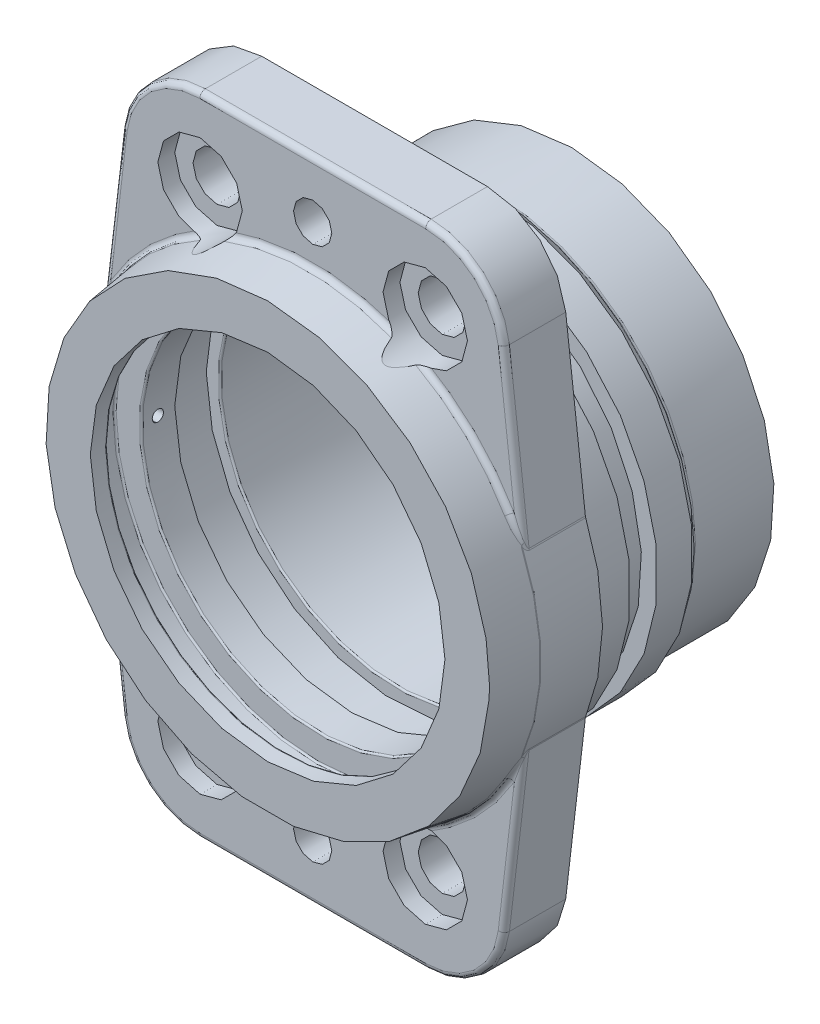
SolidWorks part; units mm, degrees
ref_plane "Face" through (0, 0, 0) normal (0, 0, 1) x (1, 0, 0)
ref_plane "Dessus" through (0, 0, 0) normal (0, 1, 0) x (1, 0, 0)
ref_plane "Droite" through (0, 0, 0) normal (1, 0, 0) x (0, 0, -1)
sketch "Esquisse1" plane through (0, 0, 0) normal (0, 0, 1) x (1, 0, 0)
  line L0 (0, -73.3205) -> (0, 88.7114) construction
  line L1 (-81.0159, 0) -> (84.0086, 0) construction
  line L2 (-20.0515, 57.5) -> (20.0515, 57.5)
  line L3 (-33.9555, 45.1369) -> (-38.7325, 4.5599)
  line L4 (33.9555, 45.1369) -> (38.7325, 4.5599)
  line L5 (33.9555, -45.1369) -> (38.7325, -4.5599)
  line L6 (-20.0515, -57.5) -> (20.0515, -57.5)
  line L7 (-33.9555, -45.1369) -> (-38.7325, -4.5599)
  arc A0 (-38.7325, 4.5599) -> (-38.7325, -4.5599) centre (0, 0) ccw
  arc A1 (-33.9555, 45.1369) -> (-20.0515, 57.5) centre (-20.0515, 43.5) cw
  arc A2 (33.9555, 45.1369) -> (20.0515, 57.5) centre (20.0515, 43.5) ccw
  arc A3 (38.7325, 4.5599) -> (38.7325, -4.5599) centre (0, 0) cw
  arc A4 (33.9555, -45.1369) -> (20.0515, -57.5) centre (20.0515, -43.5) cw
  arc A5 (-33.9555, -45.1369) -> (-20.0515, -57.5) centre (-20.0515, -43.5) ccw
  circle A6 centre (0, 0) radius 30
  point P12 (-32.5, 57.5)
  point P14 (0, 57.5)
  dimension "D2" = 39
  dimension "D4" = 14
  dimension "D5" = 60
  dimension "D1" = 57.5
  dimension "D3" = 32.5
extrude "Extrusion1" add sketch "Esquisse1" along normal blind 14
sketch "Esquisse2" plane through (0, 0, 0) normal (1, 0, 0) x (0, 0, -1)
  line L0 (0, 0) -> (-57, 0) construction
  line L1 (-25, -29.5) -> (-25, -38.1271)
  line L2 (-24.1351, -39.1179) -> (-14, -40.5)
  line L3 (0, -45.1369) -> (0, -4.5599) construction
  line L4 (16.0045, -40.5) -> (-14, -40.5)
  line L5 (17, -39.5) -> (17, -37)
  line L6 (18, -36) -> (34, -36)
  line L7 (35, -35) -> (35, -29.5)
  line L8 (34, -28.5) -> (-24, -28.5)
  line L9 (-14, -45.1369) -> (-14, -4.5599) construction
  arc A0 (-25, -29.5) -> (-24, -28.5) centre (-24, -29.5) cw
  arc A1 (-25, -38.1271) -> (-24.1351, -39.1179) centre (-24, -38.1271) ccw
  arc A3 (17, -39.5) -> (16.0045, -40.5) centre (16, -39.5) cw
  arc A4 (17, -37) -> (18, -36) centre (18, -37) cw
  arc A5 (35, -35) -> (34, -36) centre (34, -35) cw
  arc A6 (34, -28.5) -> (35, -29.5) centre (34, -29.5) cw
  point P14 (-25, -28.5)
  point P17 (-25, -39)
  point P20 (0, -40.5)
  point P25 (17, -36)
  point P28 (35, -36)
  point P31 (35, -28.5)
  dimension "D8" = 1
  dimension "D1" = 40.5
  dimension "D2" = 18
  dimension "D3" = 25
  dimension "D4" = 28.5
  dimension "D5" = 39
  dimension "D6" = 36
  dimension "D7" = 60
revolve "Révolution1" add sketch "Esquisse2" angle 360 about L0
fillet "Congé1" radius 1 20 edges at (-35.7056, -30.271, 0) (-29.3543, -53.9622, 0) (35.7056, -30.271, 0) (29.3543, -53.9622, 0) (-35.7056, -30.271, 14) (-29.3543, -53.9622, 14) (35.7056, -30.271, 14) (29.3543, -53.9622, 14) (35.7056, 30.271, 0) (29.3543, 53.9622, 0) (-35.7056, 30.271, 0) (-29.3543, 53.9622, 0) (35.7056, 30.271, 14) (29.3543, 53.9622, 14) (-35.7056, 30.271, 14) (-29.3543, 53.9622, 14) (0, -57.5, 0) (0, -57.5, 14) (0, 57.5, 0) (0, 57.5, 14)
fillet "Congé2" radius 1 16 edges at (-37.2707, 15.8477, 13.4967) (-37.4557, 15.4052, 7) (-37.4202, 15.4912, 0.7769) (0, 40.5, 0) (37.2707, 15.8477, 0.5033) (37.4557, 15.4052, 7) (37.4202, 15.4912, 13.2231) (37.2707, -15.8477, 13.4967) (37.4557, -15.4052, 7) (37.4202, -15.4912, 0.7769) (0, -40.5, 0) (-37.2707, -15.8477, 0.5033) (-37.4557, -15.4052, 7) (-37.4202, -15.4912, 13.2231) (0, 40.5, 14) (0, -40.5, 14)
fillet "Congé3" radius 1 10 edges at (-37.1036, -16.4623, 13.684) (-37.0911, -16.2718, 13.9758) (-37.1095, 16.4776, 13.6626) (-37.0943, 16.2627, 13.9806) (37.1036, 16.4623, 13.684) (37.0911, 16.2718, 13.9758) (37.1095, -16.4776, 13.6626) (37.0943, -16.2627, 13.9806) (-40.5, 0, 14) (40.5, 0, 14)
hole_wizard "Trou taraudé M8x1.251" positions "Esquisse4" profile "Esquisse3" tap size "M8x1.25" standard "Ansi Métrique"
sketch "Esquisse4" plane through (0, 0, 14) normal (0, 0, 1) x (1, 0, 0)
  line L0 (0, 0) -> (0, 62.6238) construction
  point P0 (0, 47.5)
  point P9 (0, -47.5)
  dimension "D1" = 47.5
  dimension "D2" = 47.5
sketch "Esquisse3" plane through (0, 47.5, 14) normal (1, 0, 0) x (0, -1, 0)
  line L0 (0, 0) -> (0, 21.7929)
  line L1 (0, 21.7929) -> (3.4, 19.75)
  line L2 (3.4, 19.75) -> (3.4, 0)
  line L5 (3.4, 0) -> (0, 0)
  line L10 (0, 21.7929) -> (-3.4, 19.75) construction
  line L11 (0, -6.35) -> (0, 107.95) construction
  dimension "Diamètre du trou pour taraudage" = 6.8
  dimension "Profondeur du trou pour taraudage" = 19.75
  dimension "Angle de pointe" = 118
hole_wizard "Chambrage pour vis à tête ronde bombée M51" positions "Esquisse6" profile "Esquisse5" counterbore size "M5" standard "Ansi Métrique"
sketch "Esquisse6" plane through (0, 0, 14) normal (0, 0, 1) x (1, 0, 0)
  point P0 (-20, 43)
  dimension "D1" = 43
  dimension "D2" = 20
sketch "Esquisse5" plane through (-20, 43, 14) normal (1, 0, 0) x (0, -1, 0)
  line L0 (0, 0) -> (0, 49)
  line L1 (0, 49) -> (4.25, 49)
  line L3 (4.25, 49) -> (4.25, 3)
  line L4 (4.25, 3) -> (7.5, 3)
  line L5 (7.5, 3) -> (7.5, 0)
  line L7 (7.5, 0) -> (0, 0)
  line L11 (0, -6.35) -> (0, 107.95) construction
  dimension "Diamètre du perçage jusqu'au prochain" = 8.5
  dimension "Profondeur du perçage jusqu'au prochain" = 49
  dimension "Diamètre du chambrage" = 15
  dimension "Profondeur du chambrage" = 3
pattern_linear "Répétition linéaire1" count 2 spacing 40 along (1, 0, 0) of "Chambrage pour vis à tête ronde bombée M51"
mirror "Symétrie1" about plane through (0, 0, 0) normal (0, 1, 0) of "Chambrage pour vis à tête ronde bombée M51", "Répétition linéaire1"
sketch "Esquisse7" plane through (0, 0, 14) normal (0, 0, 1) x (1, 0, 0)
  circle A0 centre (20, -43) radius 7.5 construction
  circle A2 centre (20, 43) radius 7.5 construction
  circle A3 centre (-20, 43) radius 7.5 construction
  circle A4 centre (20, -43) radius 7.5
  circle A5 centre (-20, -43) radius 7.5
  circle A6 centre (20, 43) radius 7.5
  circle A7 centre (-20, 43) radius 7.5
extrude "Enlèv. mat.-Extru.1" cut sketch "Esquisse7" along normal blind 90
ref_plane "Plan1" through (-38, 0, 0) normal (1, 0, 0) x (0, 0, -1)
sketch "Esquisse11" plane through (0, 0, 0) normal (0, 1, 0) x (1, 0, 0)
  line L0 (-35.8263, -14) -> (-21.1093, -14) construction
  line L1 (-66.7803, 24.1967) -> (-37.5, 24.1967)
  line L2 (-66.7803, 24.1967) -> (-66.7803, -3.0024)
  line L3 (-66.7803, -3.0024) -> (-37.5, -3.0024)
  line L4 (-37.5, 24.1967) -> (-37.5, 9.7976)
  line L5 (0, 0) -> (0, -57) construction
  line L6 (-37.5, 4.9976) -> (-34.65, 4.9976)
  line L7 (-34.65, 4.9976) -> (-34.65, 9.7976)
  line L8 (-34.65, 9.7976) -> (-37.5, 9.7976)
  line L9 (-37.5, 4.9976) -> (-37.5, -3.0024)
  dimension "D1" = 10.9976
  dimension "D2" = 37.5
  dimension "D3" = 8
  dimension "D4" = 4.8
  dimension "D5" = 34.65
revolve "Enlèvement de matière-Révolution1" cut sketch "Esquisse11" angle 360 about axis through (0, 0, 0) along (0, 0, 1)
sketch "Esquisse13" plane through (0, 0, 0) normal (0, 1, 0) x (1, 0, 0)
  line L0 (0, -39.3084) -> (-52.4386, -39.3084)
  line L1 (0, 0) -> (0, -57) construction
  line L2 (-52.4386, -39.3084) -> (-52.4386, -22.0024)
  line L3 (-52.4386, -22.0024) -> (-31.5, -22.0024)
  line L4 (-31.5, -22.0024) -> (-31.5, -19.0024)
  line L5 (-31.5, -19.0024) -> (-36.2, -19.0024)
  line L6 (-36.2, -19.0024) -> (-36.2, -13.0024)
  line L7 (-36.2, -13.0024) -> (-31.5, -13.0024)
  line L8 (-31.5, -13.0024) -> (-31.5, -7.0024)
  line L9 (-31.5, -7.0024) -> (-33.9, -7.0024)
  line L10 (-33.9, -7.0024) -> (-33.9, 0.9976)
  line L11 (-33.9, 0.9976) -> (-31.5, 0.9976)
  line L12 (-31.5, 0.9976) -> (-31.5, 31.9976)
  line L13 (-31.5, 31.9976) -> (-53.6631, 31.9976)
  line L14 (-53.6631, 31.9976) -> (-53.6631, 40.577)
  line L15 (-53.6631, 40.577) -> (0, 40.577)
  line L16 (0, 40.577) -> (0, -39.3084)
  line L17 (20.0515, -3.0024) -> (-20.0515, -3.0024) construction
  dimension "D1" = 19
  dimension "D2" = 35
  dimension "D3" = 31.5
  dimension "D4" = 33.9
  dimension "D5" = 36.2
  dimension "D6" = 3
  dimension "D7" = 6
  dimension "D8" = 15
  dimension "D9" = 8
revolve "Enlèvement de matière-Révolution2" cut sketch "Esquisse13" angle 360 about L16
sketch "Esquisse9" plane through (-38, 0, 0) normal (1, 0, 0) x (0, 0, -1)
  line L0 (0, 0) -> (-57, 0) construction
  line L2 (-3.0024, 15.5407) -> (-3.0024, 45.1369) construction
  circle A0 centre (-10.0024, 0) radius 1
  dimension "D1" = 2
  dimension "D2" = 7
extrude "Enlèv. mat.-Extru.2" cut sketch "Esquisse9" along normal up to next
sketch "Esquisse10" plane through (-38, 0, 0) normal (1, 0, 0) x (0, 0, -1)
  circle A0 centre (-10.0024, 0) radius 4
  dimension "D1" = 8
extrude "Enlèv. mat.-Extru.3" cut sketch "Esquisse10" against normal through all
chamfer "Chanfrein1" distance 2 angle 30 1 edges at (-31.5, 0, -31.9976)
chamfer "Chanfrein2" distance 1 angle 45 1 edges at (0, -37.5, -17)
fillet "Congé4" radius 0.3 4 edges at (-36.2, 0, 13.0024) (-31.5, 0, 19.0024) (-31.5, 0, 13.0024) (-31.5, 0, -0.9976)
